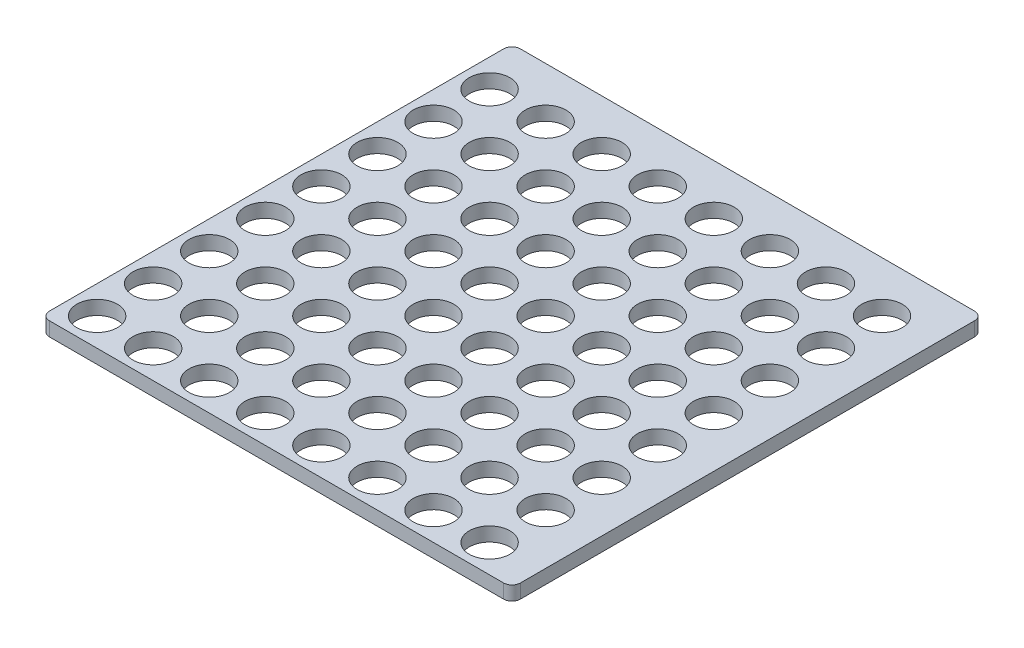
SolidWorks part; units mm, degrees
ref_plane "Front Plane" through (0, 0, 0) normal (0, 0, 1) x (1, 0, 0)
ref_plane "Top Plane" through (0, 0, 0) normal (0, 1, 0) x (1, 0, 0)
ref_plane "Right Plane" through (0, 0, 0) normal (1, 0, 0) x (0, 0, -1)
sketch "Sketch1" plane through (0, 0, 0) normal (0, 1, 0) x (1, 0, 0)
  line L1 (-84, -84) -> (84, -84)
  line L2 (-84, -84) -> (-84, 84)
  line L3 (-84, 84) -> (84, 84)
  line L4 (84, -84) -> (84, 84)
  line L5 (-84, -84) -> (84, 84) construction
  line L6 (-84, 84) -> (84, -84) construction
  point P0 (0, 0)
  dimension "D1" = 168
  dimension "D2" = 168
extrude "Boss-Extrude1" add sketch "Sketch1" along normal blind 5
fillet "Fillet1" radius 3 4 edges at (-84, 2.5, -84) (-84, 2.5, 84) (84, 2.5, 84) (84, 2.5, -84)
hole_wizard "M16x1.5 Tapped Hole1" positions "3DSketch2" profile "Sketch3" tap size "M16x1.5" standard "ISO"
sketch3d "3DSketch2"
  line L0 (-84, 0, -81) -> (-84, 0, 81) construction
  point P0 (-74, 0, -65.9975)
  dimension "D1" = 10
sketch "Sketch3" plane through (-74, 0, -65.9975) normal (1, 0, 0) x (0, 0, -1)
  line L0 (0, 0) -> (0, 5)
  line L1 (0, 5) -> (7.25, 5)
  line L2 (7.25, 5) -> (7.25, 0)
  line L5 (7.25, 0) -> (0, 0)
  line L11 (0, -6.35) -> (0, 107.95) construction
  dimension "Thru Tap Drill Dia." = 14.5
  dimension "Thru Tap Drill Depth" = 5
pattern_linear "LPattern1" count 8 spacing 20 along (1, 0, 0) of "M16x1.5 Tapped Hole1"
pattern_linear "LPattern2" count 8 spacing 20 along (0, 0, 1) of "LPattern1", "M16x1.5 Tapped Hole1"
